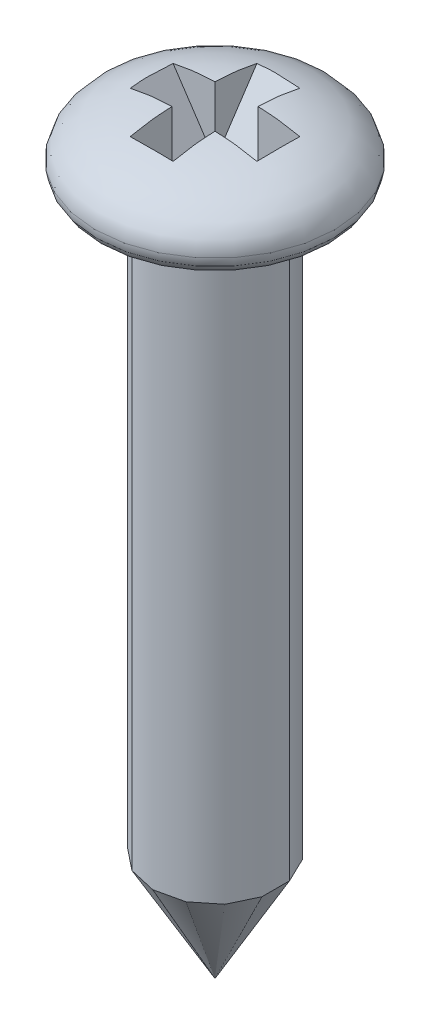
SolidWorks part; units mm, degrees
ref_plane "Plan de face" through (0, 0, 0) normal (0, 0, 1) x (1, 0, 0)
ref_plane "Plan de dessus" through (0, 0, 0) normal (0, 1, 0) x (1, 0, 0)
ref_plane "Plan de droite" through (0, 0, 0) normal (1, 0, 0) x (0, 0, -1)
ref_plane "Plan3" through (0, 6.4, 0) normal (0, 1, 0) x (-1, 0, 0)
sketch "Esquisse1" plane through (0, 6.4, 0) normal (0, 1, 0) x (-1, 0, 0)
  circle A0 centre (0, 0) radius 1.45
extrude "Extrusion1" add sketch "Esquisse1" against normal blind 16
sketch "Esquisse2" plane through (0, 0, 0) normal (0, 0, 1) x (1, 0, 0)
  line L0 (-3.5764, 6.4) -> (3.9855, 6.4) construction
  line L1 (0, 8.9067) -> (0, 4.7448) construction
  line L2 (-2.6992, 8) -> (4.0303, 8) construction
  line L3 (-2.8, 8.6386) -> (-2.8, 5.3938) construction
  line L4 (0, 6.4) -> (-2.3, 6.4)
  line L5 (0, 8) -> (0, 6.4)
  arc A0 (-2.3, 6.4) -> (-2.8, 6.9001) centre (-2.3, 6.9) cw
  spline S0 degree 3 poles (-2.8, 6.9001) (-2.802, 7.3106) (-1.7042, 7.9956) (-0.6729, 7.9983) (0, 8) knots 0 0 0 0 0.347597 1 1 1 1
  point P15 (-2.8, 6.4)
  point P18 (-2.8, 8)
  point P21 (0, 6.4)
  dimension "D1" = 0.5
revolve "Révolution1" add sketch "Esquisse2" angle 360 about L1
sketch "Esquisse3" plane through (0, 0, 0) normal (0, 0, 1) x (1, 0, 0)
  line L0 (0, 9.9885) -> (0, 5.1977) construction
  line L1 (-3.3122, 6.4) -> (4.0377, 6.4) construction
  line L2 (-3.6691, 0) -> (6.2564, 0) construction
  line L3 (-1.5, 8.9361) -> (-1.5, 5.7428) construction
  line L4 (-0.5, 7.218) -> (-0.5, 5.7428) construction
  line L5 (0, 8.589) -> (-1.5, 8.3981)
  line L6 (-2.5295, 7.9) -> (1.4809, 7.9) construction
  line L7 (-1.5, 8.3981) -> (-1.5, 7.9)
  line L8 (-1.5, 7.9) -> (-0.5, 6.4)
  line L9 (-0.5, 6.4) -> (0.5, 6.4)
  line L10 (1.5, 7.9) -> (0.5, 6.4)
  line L11 (1.5, 8.3981) -> (1.5, 7.9)
  line L12 (0, 8.589) -> (1.5, 8.3981)
  point P19 (0, 6.4)
extrude "Enlèv. mat.-Extru.1" cut sketch "Esquisse3" against normal mid plane 1
pattern_circular "Répétition circulaire1" count 2 every 90 about axis through (0, 0, 0) along (0, 1, 0) of "Enlèv. mat.-Extru.1"
chamfer "Chanfrein1" distance 1.44 distance2 2.5 1 edges at (0, -9.6, 1.45)
